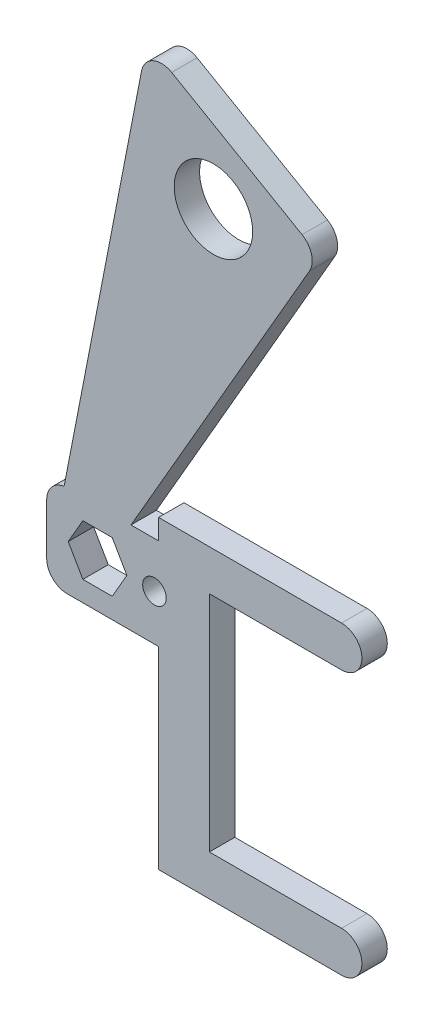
SolidWorks part; units mm, degrees
ref_plane "Front Plane" through (0, 0, 0) normal (0, 0, 1) x (1, 0, 0)
ref_plane "Top Plane" through (0, 0, 0) normal (0, 1, 0) x (1, 0, 0)
ref_plane "Right Plane" through (0, 0, 0) normal (1, 0, 0) x (0, 0, -1)
sketch "Sketch6" plane through (0, 0, 0) normal (0, 0, 1) x (1, 0, 0)
  line L0 (13.97, 11.43) -> (36.83, 11.43) construction
  line L1 (36.83, 13.97) -> (13.97, 13.97)
  line L2 (20.32, 8.89) -> (36.83, 8.89)
  line L3 (0, 11.43) -> (13.97, 11.43)
  line L4 (13.97, -21.59) -> (36.83, -21.59) construction
  line L5 (13.97, -24.13) -> (36.83, -24.13)
  line L6 (20.32, -19.05) -> (36.83, -19.05)
  line L7 (20.32, 8.89) -> (20.32, -19.05)
  line L8 (13.97, 11.43) -> (13.97, 13.97)
  line L10 (13.97, -24.13) -> (13.97, 0)
  line L11 (13.97, 0) -> (0, 0)
  line L12 (0, 11.43) -> (0, 0)
  arc A0 (36.83, 8.89) -> (36.83, 13.97) centre (36.83, 11.43) ccw
  arc A1 (36.83, -19.05) -> (36.83, -24.13) centre (36.83, -21.59) cw
  dimension "D2" = 2.54
  dimension "D4" = 11.43
  dimension "D7" = 2.54
  dimension "D1" = 6.35
  dimension "D3" = 5.08
  dimension "D5" = 38.1
  dimension "D6" = 13.97
  dimension "D8" = 5.08
  dimension "D9" = 22.86
extrude "Boss-Extrude3" add sketch "Sketch6" along normal blind 3.175
sketch "Sketch9" plane through (0, 0, 0) normal (0, 0, 1) x (1, 0, 0)
  line L1 (2.1728, 11.43) -> (10.5272, 11.43)
  line L2 (2.1728, 11.43) -> (12.5282, 64.7039)
  line L3 (12.5282, 64.7039) -> (34.0957, 52.2519)
  line L4 (10.5272, 11.43) -> (34.0957, 52.2519)
  line L5 (20.32, 8.89) -> (36.83, 8.89) construction
  line L6 (13.97, 11.43) -> (0, 11.43) construction
  dimension "D1" = 60
  dimension "D3" = 19
  dimension "D4" = 90
  dimension "D5" = 24.904
extrude "Boss-Extrude4" add sketch "Sketch9" along normal blind 3.175
hole_wizard "#4 Clearance Hole1" positions "Sketch8" profile "Sketch7" hole size "#4" standard "ANSI Inch"
sketch "Sketch8" plane through (0, 0, 3.175) normal (0, 0, 1) x (1, 0, 0)
  line L4 (2.1728, 11.43) -> (10.5272, 11.43) construction
  line L5 (0, 11.43) -> (0, 0) construction
  point P3 (6.35, 5.715)
  point P29 (6.35, 11.43)
  point P30 (13.462, 5.715)
  point P41 (0, 5.715)
  dimension "D1" = 7.112
sketch "Sketch7" plane through (6.35, 5.715, 3.175) normal (1, 0, 0) x (0, -1, 0)
  line L0 (0, 0) -> (0, 3.175)
  line L1 (0, 3.175) -> (1.4732, 3.175)
  line L2 (1.4732, 3.175) -> (1.4732, 0)
  line L5 (1.4732, 0) -> (0, 0)
  line L11 (0, -6.35) -> (0, 107.95) construction
  dimension "Thru Hole Dia." = 2.9464
  dimension "Thru Hole Depth" = 3.175
hole_wizard "3/8 Clearance Hole1" positions "Sketch11" profile "Sketch10" hole size "3/8" standard "ANSI Inch"
sketch "Sketch11" plane through (0, 0, 3.175) normal (0, 0, 1) x (1, 0, 0)
  line L0 (23.312, 58.4779) -> (6.35, 5.715) construction
  line L1 (34.0957, 52.2519) -> (12.5282, 64.7039) construction
  point P0 (20.8268, 50.7473)
  dimension "D1" = 7.9375
sketch "Sketch10" plane through (20.8268, 50.7473, 3.175) normal (1, 0, 0) x (0, -1, 0)
  line L0 (0, 0) -> (0, 3.175)
  line L1 (0, 3.175) -> (4.9022, 3.175)
  line L2 (4.9022, 3.175) -> (4.9022, 0)
  line L5 (4.9022, 0) -> (0, 0)
  line L11 (0, -6.35) -> (0, 107.95) construction
  dimension "Thru Hole Dia." = 9.8044
  dimension "Thru Hole Depth" = 3.175
sketch "Sketch12" plane through (0, 0, 3.175) normal (0, 0, 1) x (1, 0, 0)
  line L1 (8.1831, 8.89) -> (4.5169, 8.89)
  line L2 (4.5169, 8.89) -> (2.6838, 5.715)
  line L3 (2.6838, 5.715) -> (4.5169, 2.54)
  line L4 (4.5169, 2.54) -> (8.1831, 2.54)
  line L5 (8.1831, 2.54) -> (10.0162, 5.715)
  line L6 (10.0162, 5.715) -> (8.1831, 8.89)
  circle A0 centre (6.35, 5.715) radius 3.175 construction
  dimension "D1" = 6.35
extrude "Cut-Extrude1" cut sketch "Sketch12" against normal through all
fillet "Fillet1" radius 2.54 2 edges at (34.0957, 52.2519, 1.5875) (12.5282, 64.7039, 1.5875)
fillet "Fillet2" radius 2.54 2 edges at (0, 0, 1.5875) (0, 11.43, 1.5875)
